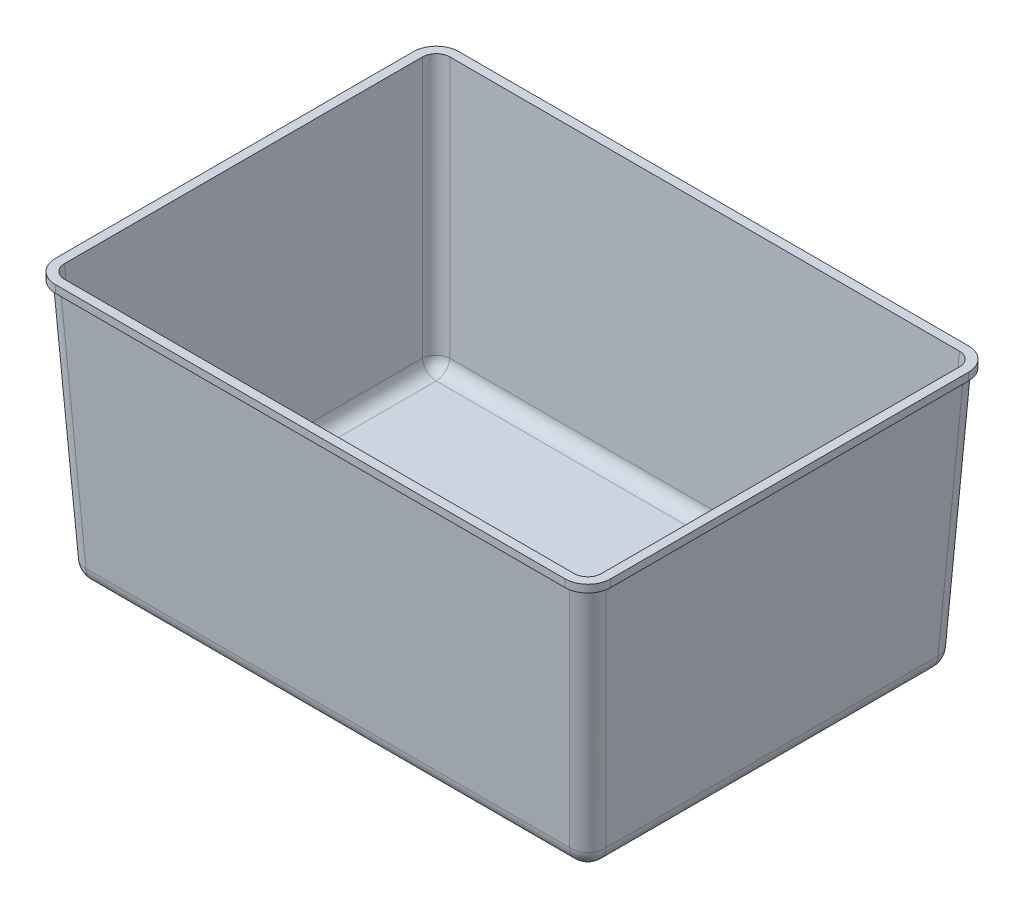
SolidWorks part; units mm, degrees
ref_plane "Plan de face" through (0, 0, 0) normal (0, 0, 1) x (1, 0, 0)
ref_plane "Plan de dessus" through (0, 0, 0) normal (0, 1, 0) x (1, 0, 0)
ref_plane "Plan de droite" through (0, 0, 0) normal (1, 0, 0) x (0, 0, -1)
sketch "Esquisse1" plane through (0, 0, 0) normal (0, 1, 0) x (1, 0, 0)
  line L1 (0, 0) -> (360, 0)
  line L2 (0, 0) -> (0, 260)
  line L3 (0, 260) -> (360, 260)
  line L4 (360, 0) -> (360, 260)
  dimension "D1" = 360
  dimension "D2" = 260
extrude "Extrusion1" add sketch "Esquisse1" against normal blind 175 draft 3
ref_plane "Plan1" through (0, 0, -130) normal (0, 0, 1) x (1, 0, 0)
ref_plane "Plan2" through (180, 0, 0) normal (1, 0, 0) x (0, 0, -1)
fillet "Congé1" radius 12 8 edges at (350.8286, -175, -130) (180, -175, -250.8286) (9.1714, -175, -130) (180, -175, -9.1714) (4.5857, -87.5, -255.4143) (355.4143, -87.5, -255.4143) (355.4143, -87.5, -4.5857) (4.5857, -87.5, -4.5857)
shell "Coque1" thickness 3
sketch "Esquisse3" plane through (0, 0, 0) normal (0, 1, 0) x (-1, 0, 0)
  line L8 (-363, -11.9836) -> (-363, -248.0164)
  line L9 (-348.0164, -263) -> (-11.9836, -263)
  line L10 (3, -248.0164) -> (3, -11.9836)
  line L11 (-11.9836, 3) -> (-348.0164, 3)
  line L12 (-363, -11.9836) -> (-363, -248.0164)
  line L13 (-348.0164, -263) -> (-11.9836, -263)
  line L14 (3, -248.0164) -> (3, -11.9836)
  line L15 (-11.9836, 3) -> (-348.0164, 3)
  line L21 (-356.9959, -11.9918) -> (-356.9959, -248.0082)
  line L22 (-11.9918, -3.0041) -> (-348.0082, -3.0041)
  line L23 (-3.0041, -248.0082) -> (-3.0041, -11.9918)
  line L24 (-348.0082, -256.9959) -> (-11.9918, -256.9959)
  line L25 (-356.9959, -11.9918) -> (-356.9959, -248.0082)
  line L26 (-11.9918, -3.0041) -> (-348.0082, -3.0041)
  line L27 (-3.0041, -248.0082) -> (-3.0041, -11.9918)
  line L28 (-348.0082, -256.9959) -> (-11.9918, -256.9959)
  ellipse E12 centre (-347.9835, -247.9835) end of major axis (-354.3649, -254.3649) minor radius 9 (-356.9959, -248.0082) -> (-348.0082, -256.9959) ccw
  ellipse E13 centre (-347.9835, -12.0165) end of major axis (-354.3649, -5.6351) minor radius 9 (-348.0082, -3.0041) -> (-356.9959, -11.9918) ccw
  ellipse E14 centre (-12.0165, -12.0165) end of major axis (-5.6351, -5.6351) minor radius 9 (-3.0041, -11.9918) -> (-11.9918, -3.0041) ccw
  ellipse E15 centre (-12.0165, -247.9835) end of major axis (-5.6351, -254.3649) minor radius 9 (-11.9918, -256.9959) -> (-3.0041, -248.0082) ccw
  ellipse E16 centre (-347.9835, -247.9835) end of major axis (-354.3649, -254.3649) minor radius 9 (-356.9959, -248.0082) -> (-348.0082, -256.9959) ccw
  ellipse E17 centre (-347.9835, -12.0165) end of major axis (-354.3649, -5.6351) minor radius 9 (-348.0082, -3.0041) -> (-356.9959, -11.9918) ccw
  ellipse E18 centre (-12.0165, -12.0165) end of major axis (-5.6351, -5.6351) minor radius 9 (-3.0041, -11.9918) -> (-11.9918, -3.0041) ccw
  ellipse E19 centre (-12.0165, -247.9835) end of major axis (-5.6351, -254.3649) minor radius 9 (-11.9918, -256.9959) -> (-3.0041, -248.0082) ccw
  spline S0 degree 3 poles (-363, -248.0164) (-363, -249.0056) (-362.9032, -249.98) (-362.6172, -251.42) (-362.4982, -251.8964) (-362.2116, -252.8417) (-362.0454, -253.3057) (-361.4837, -254.6612) (-361.0245, -255.5216) (-360.2071, -256.7464) (-359.9114, -257.1454) (-359.2881, -257.9049) (-358.9597, -258.267) (-357.9252, -259.3018) (-357.1698, -259.9236) (-355.5258, -261.0226) (-354.6634, -261.4825) (-353.3116, -262.0431) (-352.8513, -262.2083) (-351.9106, -262.4943) (-351.4292, -262.6151) (-349.9824, -262.9032) (-349.0056, -263) (-348.0164, -263) knots 0 0 0 0 0.125 0.125 0.1875 0.1875 0.25 0.25 0.375 0.375 0.4375 0.4375 0.5 0.5 0.625 0.625 0.75 0.75 0.8125 0.8125 0.875 0.875 1 1 1 1
  spline S1 degree 3 poles (-11.9836, -263) (-10.9944, -263) (-10.02, -262.9032) (-8.58, -262.6172) (-8.1036, -262.4982) (-7.1583, -262.2116) (-6.6943, -262.0454) (-5.3388, -261.4837) (-4.4784, -261.0245) (-3.2536, -260.2071) (-2.8546, -259.9114) (-2.0951, -259.2881) (-1.733, -258.9597) (-0.6982, -257.9252) (-0.0764, -257.1698) (1.0226, -255.5258) (1.4825, -254.6634) (2.0431, -253.3116) (2.2083, -252.8513) (2.4943, -251.9106) (2.6151, -251.4292) (2.9032, -249.9824) (3, -249.0056) (3, -248.0164) knots 0 0 0 0 0.125 0.125 0.1875 0.1875 0.25 0.25 0.375 0.375 0.4375 0.4375 0.5 0.5 0.625 0.625 0.75 0.75 0.8125 0.8125 0.875 0.875 1 1 1 1
  spline S2 degree 3 poles (3, -11.9836) (3, -10.9944) (2.9032, -10.02) (2.6172, -8.58) (2.4982, -8.1036) (2.2116, -7.1583) (2.0454, -6.6943) (1.4837, -5.3388) (1.0245, -4.4784) (0.2071, -3.2536) (-0.0886, -2.8546) (-0.7119, -2.0951) (-1.0403, -1.733) (-2.0748, -0.6982) (-2.8302, -0.0764) (-4.4742, 1.0226) (-5.3366, 1.4825) (-6.6884, 2.0431) (-7.1487, 2.2083) (-8.0894, 2.4943) (-8.5708, 2.6151) (-10.0176, 2.9032) (-10.9944, 3) (-11.9836, 3) knots 0 0 0 0 0.125 0.125 0.1875 0.1875 0.25 0.25 0.375 0.375 0.4375 0.4375 0.5 0.5 0.625 0.625 0.75 0.75 0.8125 0.8125 0.875 0.875 1 1 1 1
  spline S3 degree 3 poles (-348.0164, 3) (-349.0056, 3) (-349.98, 2.9032) (-351.42, 2.6172) (-351.8964, 2.4982) (-352.8417, 2.2116) (-353.3057, 2.0454) (-354.6612, 1.4837) (-355.5216, 1.0245) (-356.7464, 0.2071) (-357.1454, -0.0886) (-357.9049, -0.7119) (-358.267, -1.0403) (-359.3018, -2.0748) (-359.9236, -2.8302) (-361.0226, -4.4742) (-361.4825, -5.3366) (-362.0431, -6.6884) (-362.2083, -7.1487) (-362.4943, -8.0894) (-362.6151, -8.5708) (-362.9032, -10.0176) (-363, -10.9944) (-363, -11.9836) knots 0 0 0 0 0.125 0.125 0.1875 0.1875 0.25 0.25 0.375 0.375 0.4375 0.4375 0.5 0.5 0.625 0.625 0.75 0.75 0.8125 0.8125 0.875 0.875 1 1 1 1
  spline S4 degree 3 poles (-363, -248.0164) (-363, -249.0056) (-362.9032, -249.98) (-362.6172, -251.42) (-362.4982, -251.8964) (-362.2116, -252.8417) (-362.0454, -253.3057) (-361.4837, -254.6612) (-361.0245, -255.5216) (-360.2071, -256.7464) (-359.9114, -257.1454) (-359.2881, -257.9049) (-358.9597, -258.267) (-357.9252, -259.3018) (-357.1698, -259.9236) (-355.5258, -261.0226) (-354.6634, -261.4825) (-353.3116, -262.0431) (-352.8513, -262.2083) (-351.9106, -262.4943) (-351.4292, -262.6151) (-349.9824, -262.9032) (-349.0056, -263) (-348.0164, -263) knots 0 0 0 0 0.125 0.125 0.1875 0.1875 0.25 0.25 0.375 0.375 0.4375 0.4375 0.5 0.5 0.625 0.625 0.75 0.75 0.8125 0.8125 0.875 0.875 1 1 1 1
  spline S5 degree 3 poles (-11.9836, -263) (-10.9944, -263) (-10.02, -262.9032) (-8.58, -262.6172) (-8.1036, -262.4982) (-7.1583, -262.2116) (-6.6943, -262.0454) (-5.3388, -261.4837) (-4.4784, -261.0245) (-3.2536, -260.2071) (-2.8546, -259.9114) (-2.0951, -259.2881) (-1.733, -258.9597) (-0.6982, -257.9252) (-0.0764, -257.1698) (1.0226, -255.5258) (1.4825, -254.6634) (2.0431, -253.3116) (2.2083, -252.8513) (2.4943, -251.9106) (2.6151, -251.4292) (2.9032, -249.9824) (3, -249.0056) (3, -248.0164) knots 0 0 0 0 0.125 0.125 0.1875 0.1875 0.25 0.25 0.375 0.375 0.4375 0.4375 0.5 0.5 0.625 0.625 0.75 0.75 0.8125 0.8125 0.875 0.875 1 1 1 1
  spline S6 degree 3 poles (3, -11.9836) (3, -10.9944) (2.9032, -10.02) (2.6172, -8.58) (2.4982, -8.1036) (2.2116, -7.1583) (2.0454, -6.6943) (1.4837, -5.3388) (1.0245, -4.4784) (0.2071, -3.2536) (-0.0886, -2.8546) (-0.7119, -2.0951) (-1.0403, -1.733) (-2.0748, -0.6982) (-2.8302, -0.0764) (-4.4742, 1.0226) (-5.3366, 1.4825) (-6.6884, 2.0431) (-7.1487, 2.2083) (-8.0894, 2.4943) (-8.5708, 2.6151) (-10.0176, 2.9032) (-10.9944, 3) (-11.9836, 3) knots 0 0 0 0 0.125 0.125 0.1875 0.1875 0.25 0.25 0.375 0.375 0.4375 0.4375 0.5 0.5 0.625 0.625 0.75 0.75 0.8125 0.8125 0.875 0.875 1 1 1 1
  spline S7 degree 3 poles (-348.0164, 3) (-349.0056, 3) (-349.98, 2.9032) (-351.42, 2.6172) (-351.8964, 2.4982) (-352.8417, 2.2116) (-353.3057, 2.0454) (-354.6612, 1.4837) (-355.5216, 1.0245) (-356.7464, 0.2071) (-357.1454, -0.0886) (-357.9049, -0.7119) (-358.267, -1.0403) (-359.3018, -2.0748) (-359.9236, -2.8302) (-361.0226, -4.4742) (-361.4825, -5.3366) (-362.0431, -6.6884) (-362.2083, -7.1487) (-362.4943, -8.0894) (-362.6151, -8.5708) (-362.9032, -10.0176) (-363, -10.9944) (-363, -11.9836) knots 0 0 0 0 0.125 0.125 0.1875 0.1875 0.25 0.25 0.375 0.375 0.4375 0.4375 0.5 0.5 0.625 0.625 0.75 0.75 0.8125 0.8125 0.875 0.875 1 1 1 1
  dimension "D2" = 0
  dimension "D1" = 3
extrude "Extrusion5" add sketch "Esquisse3" against normal blind 5
